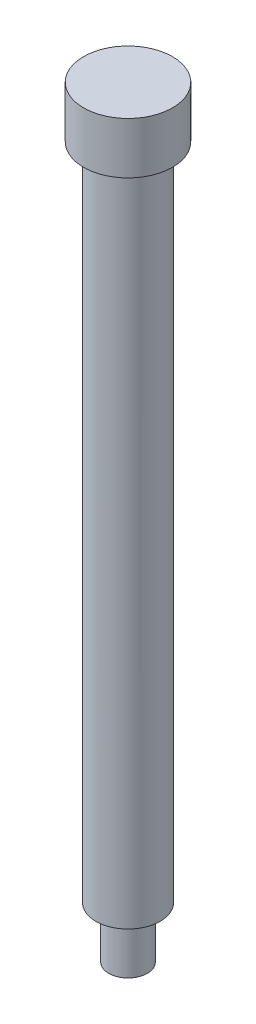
SolidWorks part; units mm, degrees
ref_plane "Front" through (0, 0, 0) normal (0, 0, 1) x (1, 0, 0)
ref_plane "Top" through (0, 0, 0) normal (0, 1, 0) x (1, 0, 0)
ref_plane "Right" through (0, 0, 0) normal (1, 0, 0) x (0, 0, -1)
sketch "Sketch1" plane through (0, 0, 0) normal (0, 0, 1) x (1, 0, 0)
  line L0 (0, 472.6111) -> (0, 282.1111) construction
  line L1 (0, 282.1111) -> (-7.9375, 282.1111) construction
  line L2 (-7.9375, 282.1111) -> (-7.9375, 457.3711) construction
  line L3 (-10.9538, 457.3711) -> (0, 457.3711) construction
  line L4 (-10.9538, 470.0711) -> (-10.9537, 371.0111) construction
  line L5 (-10.9538, 470.0711) -> (0, 470.0711) construction
  line L6 (0, 470.0711) -> (0, 282.1111)
  line L7 (0, 282.1111) -> (-7.9375, 282.1111)
  line L8 (-7.9375, 282.1111) -> (-7.9375, 457.3711)
  line L9 (-10.9538, 457.3711) -> (-7.9375, 457.3711)
  line L10 (-10.9538, 470.0711) -> (-10.9538, 457.3711)
  line L11 (-10.9538, 470.0711) -> (0, 470.0711)
  line L12 (0, 310.6861) -> (0, 454.6494) construction
  line L13 (0, 310.6861) -> (0, 454.6494) construction
revolve "Base-Revolve" add sketch "Sketch1" angle 360 about L13
sketch "Sketch2" plane through (0, 0, 0) normal (0, 0, 1) x (1, 0, 0)
  line L0 (0, 472.6111) -> (0, 282.1111) construction
  line L1 (0, 472.6111) -> (0, 282.1111) construction
  line L2 (0, 282.1111) -> (-7.9375, 282.1111) construction
  line L3 (-7.9375, 282.1111) -> (-7.9375, 457.3711) construction
  line L4 (-4.7625, 294.8111) -> (-7.9375, 294.8111) construction
  line L5 (-4.7625, 292.8807) -> (-4.7625, 282.1111) construction
  line L6 (-4.7625, 282.1111) -> (-7.9375, 282.1111)
  line L7 (-7.9375, 282.1111) -> (-7.9375, 294.8111)
  line L8 (-4.7625, 294.8111) -> (-7.9375, 294.8111)
  line L9 (-4.7625, 292.8807) -> (-4.7625, 282.1111)
  line L10 (-3.9751, 294.0237) -> (-3.9751, 293.6681) construction
  line L11 (-3.9751, 294.0237) -> (-3.9751, 293.6681)
  arc A0 (-3.9751, 294.0237) -> (-4.7625, 294.8111) centre (-4.7625, 294.0237) ccw construction
  arc A1 (-4.7625, 292.8807) -> (-3.9751, 293.6681) centre (-4.7625, 293.6681) ccw construction
  arc A2 (-3.9751, 294.0237) -> (-4.7625, 294.8111) centre (-4.7625, 294.0237) ccw
  arc A3 (-4.7625, 292.8807) -> (-3.9751, 293.6681) centre (-4.7625, 293.6681) ccw
revolve "3/8-24 UNF-2A" cut sketch "Sketch2" angle 360 about L1
